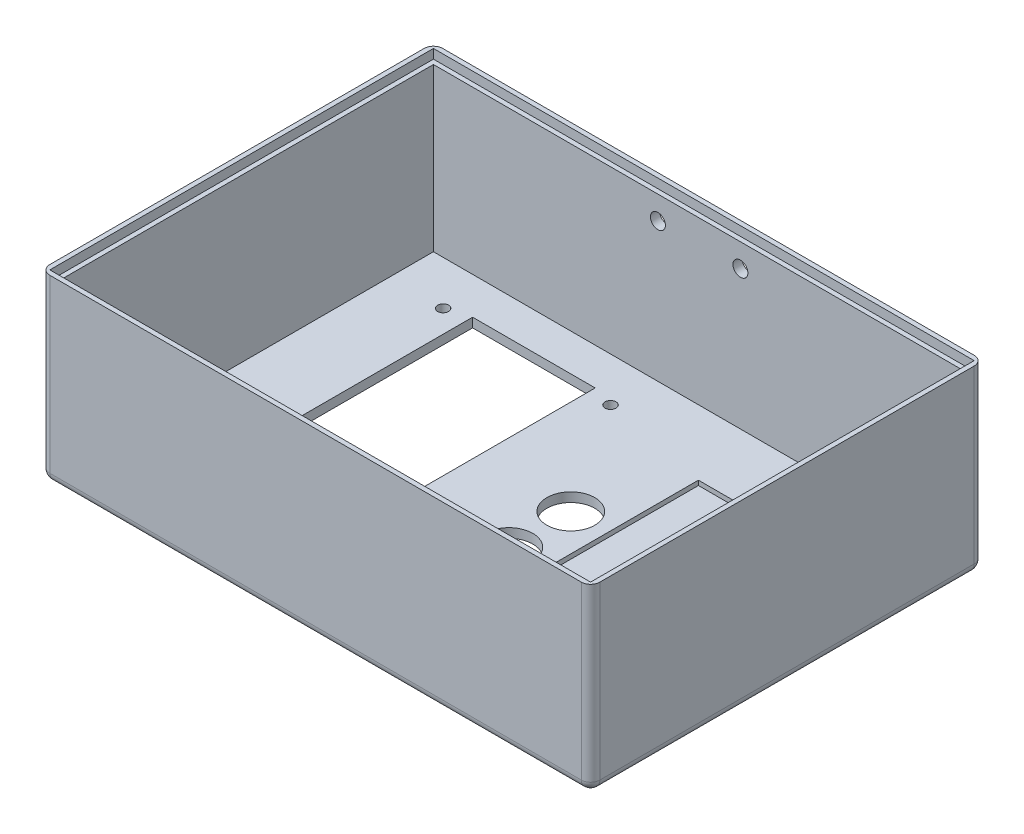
SolidWorks part; units mm, degrees
ref_plane "Front Plane" through (0, 0, 0) normal (0, 0, 1) x (1, 0, 0)
ref_plane "Top Plane" through (0, 0, 0) normal (0, 1, 0) x (1, 0, 0)
ref_plane "Right Plane" through (0, 0, 0) normal (1, 0, 0) x (0, 0, -1)
ref_plane "Plane1" through (0, 58.42, 0) normal (0, 1, 0) x (1, 0, 0)
sketch "Sketch1" plane through (0, 58.42, 0) normal (0, 1, 0) x (1, 0, 0)
  line L0 (-88.9, -63.5) -> (88.9, -63.5)
  line L1 (88.9, -63.5) -> (88.9, 63.5)
  line L2 (88.9, 63.5) -> (-88.9, 63.5)
  line L3 (-88.9, 63.5) -> (-88.9, -63.5)
extrude "Boss-Extrude1" add sketch "Sketch1" against normal blind 58.42
sketch "Sketch2" plane through (0, 58.42, 0) normal (0, 1, 0) x (-1, 0, 0)
  line L0 (87.4, 62) -> (-87.4, 62)
  line L1 (-87.4, 62) -> (-87.4, -62)
  line L2 (-87.4, -62) -> (87.4, -62)
  line L3 (87.4, -62) -> (87.4, 62)
extrude "Cut-Extrude1" cut sketch "Sketch2" against normal blind 3
sketch "Sketch3" plane through (0, 55.42, 0) normal (0, 1, 0) x (-1, 0, 0)
  line L0 (85.9, 60.5) -> (-85.9, 60.5)
  line L1 (-85.9, 60.5) -> (-85.9, -60.5)
  line L2 (-85.9, -60.5) -> (85.9, -60.5)
  line L3 (85.9, -60.5) -> (85.9, 60.5)
extrude "Cut-Extrude2" cut sketch "Sketch3" against normal blind 52.42
sketch "Sketch4" plane through (0, 3, 0) normal (0, 1, 0) x (-1, 0, 0)
  line L0 (21.624, -48.514) -> (61.248, -48.514)
  line L1 (61.248, -48.514) -> (61.248, 48.514)
  line L2 (61.248, 48.514) -> (21.624, 48.514)
  line L3 (21.624, 48.514) -> (21.624, -48.514)
extrude "Cut-Extrude3" cut sketch "Sketch4" against normal through all
sketch "Sketch5" plane through (0, 3, 0) normal (0, 1, 0) x (-1, 0, 0)
  line L0 (-20.8712, 52.0517) -> (-79.2912, 52.0517)
  line L1 (-79.2912, 52.0517) -> (-79.2912, -39.3883)
  line L2 (-79.2912, -39.3883) -> (-20.8712, -39.3883)
  line L3 (-20.8712, -39.3883) -> (-20.8712, 52.0517)
extrude "Cut-Extrude4" cut sketch "Sketch5" against normal blind 1.5
hole_wizard "M13 Clearance Hole1" positions "Sketch7" profile "Sketch6" hole size "M13" standard "ANSI Metric"
sketch "Sketch7" plane through (0, 3, 0) normal (0, 1, 0) x (1, 0, 0)
  point P0 (8.9925, -10.0168)
  point P1 (8.9925, 10.0168)
sketch "Sketch6" plane through (8.9925, 3, 10.0168) normal (1, 0, 0) x (0, 0, 1)
  line L0 (0, 0) -> (0, 3)
  line L1 (0, 3) -> (7.747, 3)
  line L2 (7.747, 3) -> (7.747, 0)
  line L5 (7.747, 0) -> (0, 0)
  line L11 (0, -6.35) -> (0, 107.95) construction
  dimension "Thru Hole Dia." = 15.494
  dimension "Thru Hole Depth" = 3
hole_wizard "M3 Clearance Hole1" positions "Sketch9" profile "Sketch8" hole size "M3" standard "ANSI Metric"
sketch "Sketch9" plane through (0, 3, 0) normal (0, 1, 0) x (1, 0, 0)
  point P0 (-68.487, 46.228)
  point P1 (-68.487, -46.228)
  point P2 (-14.385, -46.228)
  point P3 (-14.385, 46.228)
sketch "Sketch8" plane through (-68.487, 3, -46.228) normal (1, 0, 0) x (0, 0, 1)
  line L0 (0, 0) -> (0, 3)
  line L1 (0, 3) -> (1.778, 3)
  line L2 (1.778, 3) -> (1.778, 0)
  line L5 (1.778, 0) -> (0, 0)
  line L11 (0, -6.35) -> (0, 107.95) construction
  dimension "Thru Hole Dia." = 3.556
  dimension "Thru Hole Depth" = 3
fillet "Fillet1" radius 3 8 edges at (-88.9, 29.21, -63.5) (-88.9, 29.21, 63.5) (-88.9, 0, 0) (88.9, 29.21, -63.5) (0, 0, -63.5) (0, 0, 63.5) (88.9, 0, 0) (88.9, 29.21, 63.5)
sketch "Sketch10" plane through (0, 0, -63.5) normal (0, 0, -1) x (-1, 0, 0)
  line L5 (-19.05, 58.42) -> (19.05, 58.42)
  circle A0 centre (-13.335, 47.879) radius 2.413
  circle A1 centre (13.335, 47.879) radius 2.413
  point P5 (0, 0)
  dimension "D5" = 4.826
extrude "Cut-Extrude5" cut sketch "Sketch10" against normal up to surface (3 mm away) contours A0 | A1
